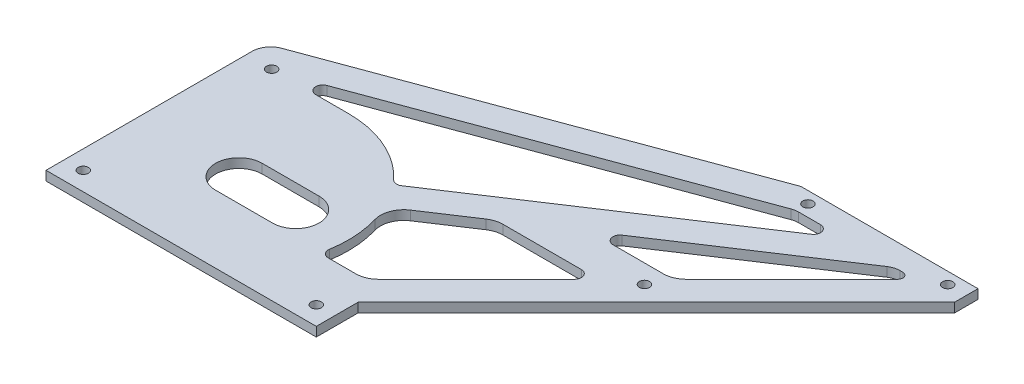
SolidWorks part; units mm, degrees
ref_plane "Plan de face" through (0, 0, 0) normal (0, 0, 1) x (1, 0, 0)
ref_plane "Plan de dessus" through (0, 0, 0) normal (0, 1, 0) x (1, 0, 0)
ref_plane "Plan de droite" through (0, 0, 0) normal (1, 0, 0) x (0, 0, -1)
sketch "Esquisse1" plane through (0, 0, 0) normal (0, 1, 0) x (1, 0, 0)
  line L0 (-9.4755, 0) -> (67.1669, 0) construction
  line L1 (0, -15.9004) -> (0, 6.7056) construction
  line L2 (-4, 40.2125) -> (-4, -4)
  line L3 (77.5531, -4) -> (-16.2033, -4) construction
  line L4 (130.1162, 4) -> (-16.2033, 4) construction
  line L5 (54, 5) -> (54, -4)
  line L6 (-4, -22.4739) -> (-4, 54.8248) construction
  line L7 (25, -10.0901) -> (25, -1.2452) construction
  line L8 (-4, -4) -> (54, -4)
  line L9 (54, 5) -> (118, 69)
  line L10 (-16.2033, 74) -> (130.1162, 74) construction
  line L11 (-16.2033, 43) -> (102.207, 43) construction
  line L12 (-1.3849, 43.9651) -> (80, 74)
  line L13 (80, 74) -> (118, 74)
  line L14 (54, -22.4739) -> (54, 8.0466) construction
  line L15 (94.9, 39) -> (-8.4386, 39) construction
  line L16 (54, 71.5) -> (125.4684, 71.5) construction
  line L17 (80, 84.3797) -> (80, 44.9289) construction
  line L18 (48.6841, 69) -> (118, 69) construction
  line L19 (-11.2059, 35) -> (102.207, 35) construction
  line L20 (-9.4755, 10) -> (80.3203, 10) construction
  line L21 (42.5779, 10) -> (48.4437, 10)
  line L22 (17.9, 39) -> (10.8882, 39)
  line L23 (98.1276, 68) -> (19.6117, 16.2099) construction
  line L24 (84.496, 69) -> (89.1969, 69)
  line L25 (10.3688, 41.9072) -> (83.1111, 68.7526)
  line L26 (104.09, 68.339) -> (69.8474, 45.7521)
  line L27 (90.0229, 66.2479) -> (37.0202, 31.2866)
  line L28 (51.9792, 11.4645) -> (72.9541, 32.4393)
  line L29 (55.0472, 35) -> (71.8934, 35)
  line L30 (114, 84.3797) -> (114, 49.806) construction
  line L31 (84, 84.3797) -> (84, 64.545) construction
  line L32 (81.4193, 50.3301) -> (81.4193, 34) construction
  line L33 (118, 69) -> (118, 74)
  line L34 (17.9, 39.5244) -> (17.9, 6.2239) construction
  line L35 (-7.4602, 15.5) -> (16.594, 15.5) construction
  line L36 (70.6733, 43) -> (81.4437, 43)
  line L37 (52.2941, 34.1738) -> (42.4912, 27.7076)
  line L38 (106.2925, 69) -> (106.8591, 69)
  line L39 (84.9792, 44.4645) -> (107.6369, 67.1222)
  line L40 (30.1, 39.5244) -> (30.1, 6.2239) construction
  line L41 (17.9, 20.5) -> (30.1, 20.5)
  line L42 (17.9, 10.5) -> (30.1, 10.5)
  circle A0 centre (0, 0) radius 1.1
  circle A1 centre (50, 0) radius 1.1
  circle A2 centre (84, 71.5) radius 1.1
  circle A3 centre (81.4193, 39) radius 1.1
  circle A4 centre (1.4193, 39) radius 1.1
  arc A5 (17.9, 20.5) -> (17.9, 10.5) centre (17.9, 15.5) ccw
  circle A6 centre (114, 71.5) radius 1.1
  arc A7 (10.3688, 41.9072) -> (10.8882, 39) centre (10.8882, 40.5) ccw
  arc A8 (41.0972, 11.74) -> (40.447, 22.1244) centre (17.9, 15.5) ccw
  arc A9 (106.8591, 69) -> (107.6369, 67.1222) centre (106.8591, 67.9) cw
  arc A10 (35.0966, 31.5165) -> (17.9, 39) centre (17.9, 15.5) ccw
  arc A11 (90.0229, 66.2479) -> (89.1969, 69) centre (89.1969, 67.5) ccw
  arc A12 (83.1111, 68.7526) -> (84.496, 69) centre (84.496, 65) cw
  arc A13 (69.8474, 45.7521) -> (70.6733, 43) centre (70.6733, 44.5) ccw
  arc A14 (71.8934, 35) -> (72.9541, 32.4393) centre (71.8934, 33.5) cw
  arc A15 (-4, 40.2125) -> (-1.3849, 43.9651) centre (0, 40.2125) cw
  arc A16 (41.0972, 11.74) -> (42.5779, 10) centre (42.5779, 11.5) ccw
  arc A17 (35.0966, 31.5165) -> (37.0202, 31.2866) centre (36.1943, 32.5388) ccw
  arc A18 (42.4912, 27.7076) -> (40.447, 22.1244) centre (45.2442, 23.5339) ccw
  arc A19 (51.9792, 11.4645) -> (48.4437, 10) centre (48.4437, 15) cw
  arc A20 (52.2941, 34.1738) -> (55.0472, 35) centre (55.0472, 30) cw
  arc A21 (104.09, 68.339) -> (106.2925, 69) centre (106.2925, 65) cw
  arc A22 (84.9792, 44.4645) -> (81.4437, 43) centre (81.4437, 48) cw
  arc A23 (30.1, 10.5) -> (30.1, 20.5) centre (30.1, 15.5) ccw
  point P54 (2.4912, 39)
  point P70 (109.5147, 69)
  point P72 (94.1952, 69)
  point P79 (83.7815, 69)
  point P80 (13.5428, 43)
  point P83 (109.5147, 69)
  point P85 (65.675, 43)
  point P89 (-4, 43)
  point P99 (75.5147, 35)
  point P102 (40.7473, 10)
  point P109 (50.5147, 10)
  point P112 (53.5467, 35)
  point P115 (105.0921, 69)
  point P118 (83.5147, 43)
  point P119 (105.0921, 69)
  dimension "D2" = 4
  dimension "D12" = 5
  dimension "D18" = 6
  dimension "D19" = 1.1
  dimension "D20" = 6
  dimension "D21" = 4
  dimension "D22" = 4
  dimension "D23" = 1.5
  dimension "D27" = 5
  dimension "D17" = 3
  dimension "D16" = 1.5
  dimension "D28" = 4
  dimension "D29" = 12.2
  dimension "D1" = 39
  dimension "D3" = 8
  dimension "D4" = 25
  dimension "D5" = 4
  dimension "D6" = 70
  dimension "D7" = 45
  dimension "D8" = 30
  dimension "D9" = 58
  dimension "D10" = 4
  dimension "D11" = 2.5
  dimension "D13" = 8
  dimension "D14" = 6
  dimension "D15" = 6
  dimension "D24" = 4
  dimension "D25" = 11.5
  dimension "D26" = 21.9
extrude "Boss.-Extru.1" add sketch "Esquisse1" along normal blind 2
